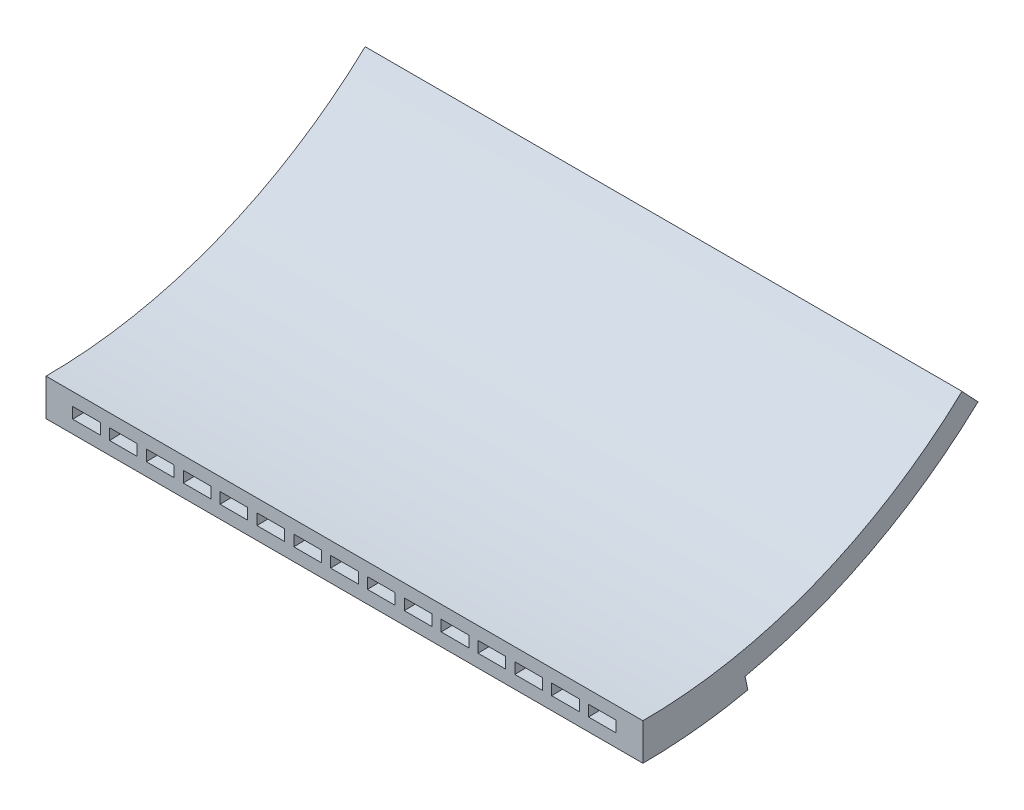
SolidWorks part; units mm, degrees
ref_plane "Přední rovina" through (0, 0, 0) normal (0, 0, 1) x (1, 0, 0)
ref_plane "Horní rovina" through (0, 0, 0) normal (0, 1, 0) x (1, 0, 0)
ref_plane "Pravá rovina" through (0, 0, 0) normal (1, 0, 0) x (0, 0, -1)
sketch "Skica1" plane through (0, 0, 0) normal (0, 0, 1) x (1, 0, 0)
  line L0 (10, 0) -> (10, 3)
  line L1 (0, 0) -> (7.5, 0)
  line L2 (0, 0) -> (0, 3)
  line L3 (0, 3) -> (7.5, 3)
  line L4 (7.5, 0) -> (7.5, 3)
  line L5 (10, 3) -> (17.5, 3)
  line L6 (17.5, 0) -> (17.5, 3)
  line L7 (10, 0) -> (17.5, 0)
  line L8 (20, 0) -> (20, 3)
  line L9 (20, 3) -> (27.5, 3)
  line L10 (27.5, 0) -> (27.5, 3)
  line L11 (20, 0) -> (27.5, 0)
  line L12 (30, 0) -> (30, 3)
  line L13 (30, 3) -> (37.5, 3)
  line L14 (37.5, 0) -> (37.5, 3)
  line L15 (30, 0) -> (37.5, 0)
  line L16 (40, 0) -> (40, 3)
  line L17 (40, 3) -> (47.5, 3)
  line L18 (47.5, 0) -> (47.5, 3)
  line L19 (40, 0) -> (47.5, 0)
  line L20 (50, 0) -> (50, 3)
  line L21 (50, 3) -> (57.5, 3)
  line L22 (57.5, 0) -> (57.5, 3)
  line L23 (50, 0) -> (57.5, 0)
  line L24 (60, 0) -> (60, 3)
  line L25 (60, 3) -> (67.5, 3)
  line L26 (67.5, 0) -> (67.5, 3)
  line L27 (60, 0) -> (67.5, 0)
  line L28 (70, 0) -> (70, 3)
  line L29 (70, 3) -> (77.5, 3)
  line L30 (77.5, 0) -> (77.5, 3)
  line L31 (70, 0) -> (77.5, 0)
  line L32 (80, 0) -> (80, 3)
  line L33 (80, 3) -> (87.5, 3)
  line L34 (87.5, 0) -> (87.5, 3)
  line L35 (80, 0) -> (87.5, 0)
  line L36 (90, 0) -> (90, 3)
  line L37 (90, 3) -> (97.5, 3)
  line L38 (97.5, 0) -> (97.5, 3)
  line L39 (90, 0) -> (97.5, 0)
  line L40 (100, 0) -> (100, 3)
  line L41 (100, 3) -> (107.5, 3)
  line L42 (107.5, 0) -> (107.5, 3)
  line L43 (100, 0) -> (107.5, 0)
  line L44 (110, 0) -> (110, 3)
  line L45 (110, 3) -> (117.5, 3)
  line L46 (117.5, 0) -> (117.5, 3)
  line L47 (110, 0) -> (117.5, 0)
  line L48 (120, 0) -> (120, 3)
  line L49 (120, 3) -> (127.5, 3)
  line L50 (127.5, 0) -> (127.5, 3)
  line L51 (120, 0) -> (127.5, 0)
  line L52 (130, 0) -> (130, 3)
  line L53 (130, 3) -> (137.5, 3)
  line L54 (137.5, 0) -> (137.5, 3)
  line L55 (130, 0) -> (137.5, 0)
  line L56 (140, 0) -> (140, 3)
  line L57 (140, 3) -> (147.5, 3)
  line L58 (147.5, 0) -> (147.5, 3)
  line L59 (140, 0) -> (147.5, 0)
  line L60 (0, 0) -> (10, 0) construction
  line L61 (0, 3) -> (7.5, 0) construction
  line L62 (-11.2265, 1.5) -> (152.7122, 1.5) construction
  line L63 (3.75, 1.5) -> (-7.25, 1.5) construction
  line L64 (-7.25, 1.5) -> (-7.25, -3.5) construction
  line L65 (140, 3) -> (147.5, 0) construction
  line L66 (143.75, 1.5) -> (154.75, 1.5)
  line L67 (154.75, 1.5) -> (154.75, 6.5) construction
  line L68 (-7.25, 1.5) -> (-7.25, 133.5) construction
  line L69 (-7.25, -3.5) -> (154.75, -3.5)
  line L70 (-7.25, -3.5) -> (-7.25, 6.5)
  line L71 (-7.25, 6.5) -> (154.75, 6.5)
  line L72 (154.75, -3.5) -> (154.75, 6.5)
  line L73 (-7.25, 133.5) -> (24, 133.5) construction
  dimension "D1" = 7.5
  dimension "D2" = 3
  dimension "D4" = 10
  dimension "D5" = 11
  dimension "D6" = 5
  dimension "D7" = 11
  dimension "D8" = 5
  dimension "D9" = 132
  dimension "D10" = 162
  dimension "D3" = 15
revolve "Rotovat1" add sketch "Skica1" angle 140 about L73
sketch "Skica4" plane through (0, 0, 0) normal (0, 1, 0) x (1, 0, 0)
  line L1 (17.5, 0) -> (17.5, -12.035) construction
  line L2 (28.75, -9.5093) -> (17.5, -9.5093) construction
  arc A0 (27.5, 0) -> (30, 0) centre (28.75, 0) ccw
  arc A1 (20, 0) -> (37.5, 0) centre (28.75, -2.1065) ccw
  arc A2 (28.75, -9.5093) -> (17.5, 0) centre (28.75, 1.9) cw
  arc A3 (28.75, -9.5093) -> (40, 0) centre (28.75, 1.9) ccw
sketch "Skica6" plane through (0, 0, 0) normal (0, 0, 1) x (1, 0, 0)
  line L1 (20, 0) -> (27.5, 0)
  line L2 (20, 0) -> (20, 3)
  line L3 (20, 3) -> (27.5, 3)
  line L4 (27.5, 0) -> (27.5, 3)
  line L5 (10, 0) -> (17.5, 0)
  line L6 (10, 0) -> (10, 3)
  line L7 (10, 3) -> (17.5, 3)
  line L8 (17.5, 0) -> (17.5, 3)
  line L9 (0, 0) -> (7.5, 0)
  line L10 (0, 0) -> (0, 3)
  line L11 (0, 3) -> (7.5, 3)
  line L12 (7.5, 0) -> (7.5, 3)
scale "Měřítko1" scale about origin uniform scaling yes scale factor 0.655
sketch "Skica7" plane through (101.3612, 0, 0) normal (1, 0, 0) x (0, 0, -1)
  line L0 (0, -2.2925) -> (0, 245.1464) construction
  line L1 (57.6805, 156.1835) -> (0, 87.4425)
  line L2 (0, 87.4425) -> (73.6457, 8.4672)
  circle A0 centre (0, 87.4425) radius 107.9851
  dimension "D1" = 97
extrude "Odebrat vysunutím1" cut sketch "Skica7" against normal through all contours L2 M3 M5 M6
sketch "Skica8" plane through (101.3612, 0, 0) normal (1, 0, 0) x (0, 0, -1)
  line L0 (0, 0) -> (0, 1.965) construction
  line L1 (0, 0) -> (0, 1.965)
  line L2 (61.1991, 21.8145) -> (56.732, 26.6048)
  line L3 (0, 4.2575) -> (0, -2.2925)
  line L4 (61.1991, 21.8145) -> (56.732, 26.6048)
  line L5 (0, 4.2575) -> (0, -2.2925)
  line L6 (0, -2.2925) -> (0, 4.2575) construction
  line L7 (0, 87.4425) -> (18.657, -0.3316)
  circle A0 centre (0, 87.4425) radius 87.3425
  arc A2 (0, 4.2575) -> (56.732, 26.6048) centre (0, 87.4425) ccw
  arc A3 (0, -2.2925) -> (61.1991, 21.8145) centre (0, 87.4425) ccw
  arc A4 (0, 4.2575) -> (56.732, 26.6048) centre (0, 87.4425) ccw
  arc A5 (0, -2.2925) -> (61.1991, 21.8145) centre (0, 87.4425) ccw
  point P9 (0, 0.1)
  dimension "D2" = 0.1
  dimension "D3" = 12
  dimension "D1" = 0
extrude "Odebrat vysunutím2" cut sketch "Skica8" against normal through all contours A0 L7 M8 M5 | A5 L4 A4 L5
